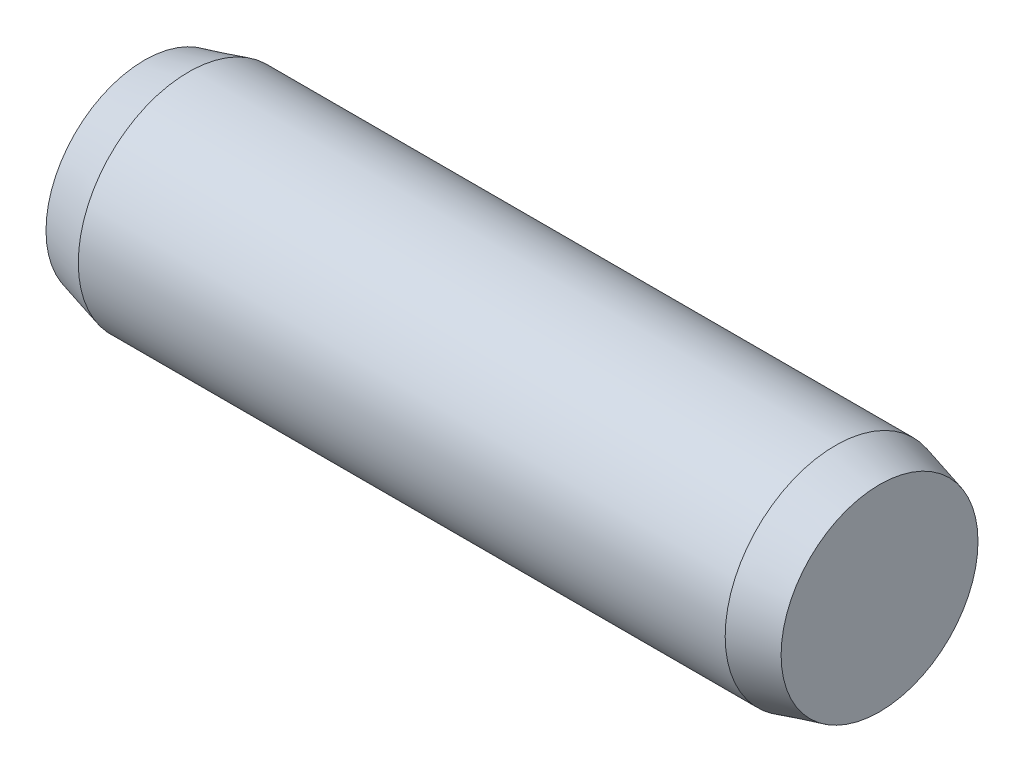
SolidWorks part; units mm, degrees
ref_plane "Front" through (0, 0, 0) normal (0, 0, 1) x (1, 0, 0)
ref_plane "Top" through (0, 0, 0) normal (0, 1, 0) x (1, 0, 0)
ref_plane "Right" through (0, 0, 0) normal (1, 0, 0) x (0, 0, -1)
sketch "Sketch1" plane through (0, 0, 0) normal (0, 0, 1) x (1, 0, 0)
  line L0 (0, 0) -> (2, 0)
  line L1 (2, 0) -> (2, 0.2678)
  line L2 (2, 0.2678) -> (1.88, 0.3)
  line L3 (1.88, 0.3) -> (0.12, 0.3)
  line L4 (0.12, 0.3) -> (0, 0.2678)
  line L5 (0, 0.2678) -> (0, 0)
  line L6 (-1.6557, 0) -> (2.6973, 0) construction
  dimension "l" = 2
  dimension "D2" = 15
  dimension "D3" = 15
  dimension "d" = 0.6
  dimension "c" = 0.12
  dimension "D6" = 0.12
revolve "Base-Revolve" add sketch "Sketch1" angle 360 about L6
equation "\"D6@Sketch1\" = \"c@Sketch1\""
